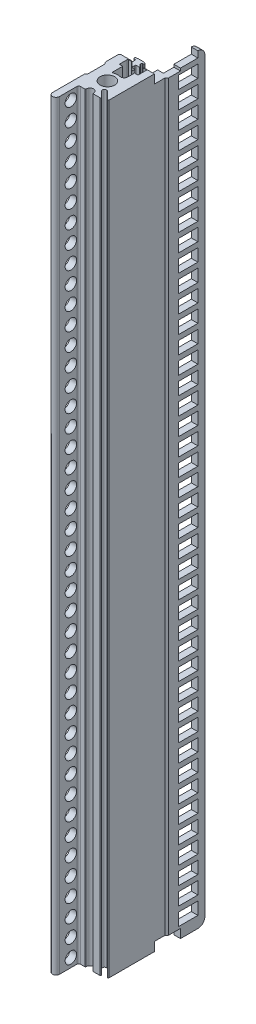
SolidWorks part; units mm, degrees
ref_plane "前视基准面" through (0, 0, 0) normal (0, 0, 1) x (1, 0, 0)
ref_plane "上视基准面" through (0, 0, 0) normal (0, 1, 0) x (1, 0, 0)
ref_plane "右视基准面" through (0, 0, 0) normal (1, 0, 0) x (0, 0, -1)
sketch "草图1" plane through (0, 0, 0) normal (0, 1, 0) x (1, 0, 0)
  line L0 (-4.2, 11.9) -> (-3.9, 11.9)
  line L1 (-4.4, 12.2) -> (-4.4, 12.1)
  line L2 (-4.0328, 12.4) -> (-4.2, 12.4)
  line L3 (-3.85, 12.5) -> (-3.8914, 12.4586)
  line L4 (-2.05, 12.5) -> (-3.85, 12.5)
  line L5 (-2.0086, 12.4586) -> (-2.05, 12.5)
  line L6 (-1.7, 12.4) -> (-1.8672, 12.4)
  line L7 (-1.5, 12.1) -> (-1.5, 12.2)
  line L8 (-1.8, 11.9) -> (-1.7, 11.9)
  line L9 (-2, 11.4828) -> (-2, 11.7)
  line L10 (-1.3586, 10.7586) -> (-1.9414, 11.3414)
  line L11 (-1.3, 10.55) -> (-1.3, 10.6172)
  line L12 (-3.7, 11.7) -> (-3.7, 9.95)
  line L13 (-5, -10.75) -> (-5, -1.6)
  line L14 (-3, -10.75) -> (-3, -5.75)
  line L15 (-2.5, -5.25) -> (-1.15, -5.25)
  line L16 (1.6887, -3.3855) -> (3.2118, -4.9086)
  line L17 (2.5373, -2.537) -> (4.6586, -4.6583)
  line L18 (5, 15) -> (5, 5.1793)
  line L19 (3.6, 15) -> (5, 15)
  line L20 (3.6, 12.5) -> (3.6, 15)
  line L21 (1.95, 12.5) -> (3.6, 12.5)
  line L22 (1.95, 10.55) -> (1.95, 12.5)
  line L23 (2.85, 10.55) -> (1.95, 10.55)
  line L24 (2.85, 9.35) -> (2.85, 10.55)
  line L25 (1.95, 9.35) -> (2.85, 9.35)
  line L26 (1.95, 8.35) -> (1.95, 9.35)
  line L27 (2.85, 8.35) -> (1.95, 8.35)
  line L28 (2.85, 6.05) -> (2.85, 8.35)
  line L29 (1.95, 6.05) -> (2.85, 6.05)
  line L30 (1.95, 3.8856) -> (1.95, 6.05)
  line L31 (-1.45, 6.05) -> (-1.45, 2.9458)
  line L32 (-2.35, 6.05) -> (-1.45, 6.05)
  line L33 (-2.35, 8.35) -> (-2.35, 6.05)
  line L34 (-1.45, 8.35) -> (-2.35, 8.35)
  line L35 (-1.45, 9.35) -> (-1.45, 8.35)
  line L36 (-2.35, 9.35) -> (-1.45, 9.35)
  line L37 (-2.35, 10.55) -> (-2.35, 9.35)
  line L38 (-1.3, 10.55) -> (-2.35, 10.55)
  line L39 (-4.45, 7.7) -> (-4.7, 7.7) construction
  line L40 (-5, 7.4) -> (-4.7, 7.7) construction
  line L41 (-5, 4.4) -> (-5, 7.4)
  line L42 (-4.5499, 3.8998) -> (-5, 4.4)
  line L43 (-4.45, 8.5) -> (-4.45, 9.55)
  line L44 (-3.9, 9.75) -> (-4.25, 9.75)
  line L45 (-4.5499, 3.8998) -> (-4.5501, -1.1002)
  line L46 (-5, -1.6) -> (-4.5501, -1.1002)
  line L47 (4.9414, -1.9395) -> (4.6464, -1.6446) construction
  line L48 (5, -2.081) -> (5, -4.5169)
  line L49 (0, 0) -> (0, -5) construction
  line L50 (4.5, -1.291) -> (4.5, 4.3894) construction
  line L51 (-1.05, -5) -> (-1.05, -5.15)
  line L52 (1.05, -5) -> (1.05, -5.15)
  line L53 (1.15, -5.25) -> (3.0703, -5.25)
  line L54 (2.5373, -2.537) -> (1.6887, -3.3855) construction
  line L55 (5, 5.1793) -> (5, -2.081)
  line L56 (-4.45, 8.5) -> (-4.7, 8.5)
  line L57 (-4.7, 8.5) -> (-5, 8.2)
  line L58 (4.9414, 5.0379) -> (4.6464, 4.743) construction
  line L59 (-5, 8.2) -> (-5, 7.4)
  circle A0 centre (0, 0) radius 1.6
  arc A1 (-4.4, 12.1) -> (-4.2, 11.9) centre (-4.2, 12.1) ccw
  arc A2 (-4.2, 12.4) -> (-4.4, 12.2) centre (-4.2, 12.2) ccw
  arc A3 (-4.0328, 12.4) -> (-3.8914, 12.4586) centre (-4.0328, 12.6) ccw
  arc A4 (-2.0086, 12.4586) -> (-1.8672, 12.4) centre (-1.8672, 12.6) ccw
  arc A5 (-1.5, 12.2) -> (-1.7, 12.4) centre (-1.7, 12.2) ccw
  arc A6 (-1.7, 11.9) -> (-1.5, 12.1) centre (-1.7, 12.1) ccw
  arc A7 (-1.8, 11.9) -> (-2, 11.7) centre (-1.8, 11.7) ccw
  arc A8 (-2, 11.4828) -> (-1.9414, 11.3414) centre (-1.8, 11.4828) ccw
  arc A9 (-1.3, 10.6172) -> (-1.3586, 10.7586) centre (-1.5, 10.6172) ccw
  arc A10 (-5, -10.75) -> (-3, -10.75) centre (-4, -10.75) ccw
  arc A11 (3.0703, -5.25) -> (3.2118, -4.9086) centre (3.0703, -5.05) ccw
  arc A12 (-4.25, 9.75) -> (-4.45, 9.55) centre (-4.25, 9.55) ccw
  arc A13 (-3.9, 9.75) -> (-3.7, 9.95) centre (-3.9, 9.95) ccw
  arc A14 (5, -2.081) -> (4.9414, -1.9395) centre (4.8, -2.081) ccw construction
  arc A15 (4.9414, 5.0379) -> (5, 5.1793) centre (4.8, 5.1793) ccw construction
  arc A16 (4.6586, -4.6583) -> (5, -4.5169) centre (4.8, -4.5169) ccw
  arc A17 (2.5373, -2.537) -> (1.6887, -3.3855) centre (2.113, -2.9613) ccw
  arc A18 (0.7125, 2.9142) -> (-1.1719, 2.7616) centre (0, 0) ccw
  arc A19 (-1.45, 2.9458) -> (-1.1719, 2.7616) centre (-1.25, 2.9458) ccw
  arc A20 (0.7125, 2.9142) -> (1.95, 3.8856) centre (0.95, 3.8856) ccw
  arc A21 (-3.7, 11.7) -> (-3.9, 11.9) centre (-3.9, 11.7) ccw
  arc A22 (4.6464, -1.6446) -> (4.5, -1.291) centre (5, -1.291) cw construction
  arc A23 (4.5, 4.3894) -> (4.6464, 4.743) centre (5, 4.3894) cw construction
  arc A24 (1.05, -5) -> (-1.05, -5) centre (0, -5) ccw
  arc A25 (1.15, -5.25) -> (1.05, -5.15) centre (1.15, -5.15) cw
  arc A26 (-1.05, -5.15) -> (-1.15, -5.25) centre (-1.15, -5.15) cw
  arc A29 (-3, -5.75) -> (-2.5, -5.25) centre (-2.5, -5.75) cw
  point P104 (1.05, -5.25)
  dimension "D1" = 3.2
  dimension "D2" = 2.1
  dimension "D3" = 5.2
  dimension "D4" = 45
  dimension "D5" = 1.2
  dimension "D7" = 0.6
  dimension "D8" = 0.2
  dimension "D10" = 5
  dimension "D11" = 0.1
  dimension "D12" = 0.5
  dimension "D13" = 0.5
  dimension "D6" = 3
  dimension "D9" = 2.1225
  dimension "D14" = 0.25
  dimension "D15" = 0.8
extrude "凸台-拉伸1" add sketch "草图1" along normal mid plane 218.44
sketch "草图8" plane through (0, -109.22, 0) normal (0, -1, 0) x (-1, 0, 0)
  line L0 (2.35, 8.35) -> (1.45, 8.35) construction
  line L1 (-2.95, 5.85) -> (2.45, 5.85)
  line L2 (-2.95, 5.85) -> (-2.95, 8.35)
  line L3 (-2.95, 8.35) -> (2.45, 8.35)
  line L4 (2.45, 5.85) -> (2.45, 8.35)
  line L5 (-2.85, 8.35) -> (-2.85, 6.05) construction
  line L6 (2.35, 6.05) -> (2.35, 8.35) construction
  line L7 (1.45, 6.05) -> (2.35, 6.05) construction
  line L8 (-2.85, 9.35) -> (-1.95, 9.35) construction
  line L9 (-2.95, 9.35) -> (2.45, 9.35)
  line L10 (-2.95, 9.35) -> (-2.95, 10.55)
  line L11 (-2.95, 10.55) -> (2.45, 10.55)
  line L12 (2.45, 9.35) -> (2.45, 10.55)
  line L13 (2.35, 10.55) -> (1.3, 10.55) construction
  line L14 (-2.85, 10.55) -> (-2.85, 9.35) construction
  line L15 (2.35, 9.35) -> (2.35, 10.55) construction
  dimension "D1" = 0.1
  dimension "D2" = 0.1
  dimension "D3" = 0.2
  dimension "D4" = 0.1
  dimension "D5" = 0.1
extrude "切除-拉伸6" cut sketch "草图8" against normal through all
fillet "圆角2" radius 0.2 8 edges at (-2.45, 0, -5.85) (2.95, 0, -8.35) (2.95, 0, -5.85) (-2.45, 0, -8.35) (-2.45, 0, -9.35) (2.95, 0, -10.55) (2.95, 0, -9.35) (-2.45, 0, -10.55)
sketch "草图6" plane through (0, 109.22, 0) normal (0, 1, 0) x (1, 0, 0)
  line L0 (3.6, 12.5) -> (3.6, 22.5)
  line L1 (3.6, 22.5) -> (5.5, 22.5)
  line L2 (5.5, 22.5) -> (5.5, 12)
  line L3 (5.5, 12) -> (5, 11.5)
  line L4 (3.6, 12.5) -> (5, 11.5)
  line L5 (5, -4.5169) -> (5, 15) construction
  line L6 (-5, 8.2) -> (-5, 4.4) construction
  dimension "D4" = 11
  dimension "D1" = 10.5
  dimension "D2" = 10
  dimension "D3" = 45
extrude "凸台-拉伸2" add sketch "草图6" against normal up to surface (218.44 mm away)
sketch "草图2" plane through (0, 109.22, 0) normal (0, 1, 0) x (1, 0, 0)
  circle A0 centre (0, 0) radius 2.1
  dimension "D1" = 4.2
extrude "切除-拉伸1" cut sketch "草图2" against normal blind 10
sketch "草图3" plane through (0, -109.22, 0) normal (0, -1, 0) x (1, 0, 0)
  circle A0 centre (0, 0) radius 2.1
  dimension "D1" = 4.2
extrude "切除-拉伸2" cut sketch "草图3" against normal blind 10
sketch "草图4" plane through (-5, 0, 0) normal (-1, 0, 0) x (0, 0, 1)
  line L0 (1.6, -109.22) -> (10.75, -109.22) construction
  line L1 (11.75, -109.22) -> (11.75, 109.22) construction
  circle A0 centre (7.5, -106.68) radius 1.65
  circle A1 centre (7.5, -101.6) radius 1.65
  circle A2 centre (7.5, -96.52) radius 1.65
  circle A3 centre (7.5, -91.44) radius 1.65
  circle A4 centre (7.5, -86.36) radius 1.65
  circle A5 centre (7.5, -81.28) radius 1.65
  circle A6 centre (7.5, -76.2) radius 1.65
  circle A7 centre (7.5, -71.12) radius 1.65
  circle A8 centre (7.5, -66.04) radius 1.65
  circle A9 centre (7.5, -60.96) radius 1.65
  circle A10 centre (7.5, -55.88) radius 1.65
  circle A11 centre (7.5, -50.8) radius 1.65
  circle A12 centre (7.5, -45.72) radius 1.65
  circle A13 centre (7.5, -40.64) radius 1.65
  circle A14 centre (7.5, -35.56) radius 1.65
  circle A15 centre (7.5, -30.48) radius 1.65
  circle A16 centre (7.5, -25.4) radius 1.65
  circle A17 centre (7.5, -20.32) radius 1.65
  circle A18 centre (7.5, -15.24) radius 1.65
  circle A19 centre (7.5, -10.16) radius 1.65
  circle A20 centre (7.5, -5.08) radius 1.65
  circle A21 centre (7.5, 0) radius 1.65
  circle A22 centre (7.5, 5.08) radius 1.65
  circle A23 centre (7.5, 10.16) radius 1.65
  circle A24 centre (7.5, 15.24) radius 1.65
  circle A25 centre (7.5, 20.32) radius 1.65
  circle A26 centre (7.5, 25.4) radius 1.65
  circle A27 centre (7.5, 30.48) radius 1.65
  circle A28 centre (7.5, 35.56) radius 1.65
  circle A29 centre (7.5, 40.64) radius 1.65
  circle A30 centre (7.5, 45.72) radius 1.65
  circle A31 centre (7.5, 50.8) radius 1.65
  circle A32 centre (7.5, 55.88) radius 1.65
  circle A33 centre (7.5, 60.96) radius 1.65
  circle A34 centre (7.5, 66.04) radius 1.65
  circle A35 centre (7.5, 71.12) radius 1.65
  circle A36 centre (7.5, 76.2) radius 1.65
  circle A37 centre (7.5, 81.28) radius 1.65
  circle A38 centre (7.5, 86.36) radius 1.65
  circle A39 centre (7.5, 91.44) radius 1.65
  circle A40 centre (7.5, 96.52) radius 1.65
  circle A41 centre (7.5, 101.6) radius 1.65
  circle A42 centre (7.5, 106.68) radius 1.65
  circle A43 centre (7.5, 111.76) radius 1.65
  circle A44 centre (7.5, 116.84) radius 1.65
  circle A45 centre (7.5, 121.92) radius 1.65
  circle A46 centre (7.5, 127) radius 1.65
  circle A47 centre (7.5, 132.08) radius 1.65
  circle A48 centre (7.5, 137.16) radius 1.65
  circle A49 centre (7.5, 142.24) radius 1.65
  circle A50 centre (7.5, 147.32) radius 1.65
  circle A51 centre (7.5, 152.4) radius 1.65
  circle A52 centre (7.5, 157.48) radius 1.65
  circle A53 centre (7.5, 162.56) radius 1.65
  circle A54 centre (7.5, 167.64) radius 1.65
  circle A55 centre (7.5, 172.72) radius 1.65
  circle A56 centre (7.5, 177.8) radius 1.65
  circle A57 centre (7.5, 182.88) radius 1.65
  circle A58 centre (7.5, 187.96) radius 1.65
  circle A59 centre (7.5, 193.04) radius 1.65
  circle A60 centre (7.5, 198.12) radius 1.65
  circle A61 centre (7.5, 203.2) radius 1.65
  circle A62 centre (7.5, 208.28) radius 1.65
  circle A63 centre (7.5, 213.36) radius 1.65
  circle A64 centre (7.5, 218.44) radius 1.65
  circle A65 centre (7.5, 223.52) radius 1.65
  circle A66 centre (7.5, 228.6) radius 1.65
  circle A67 centre (7.5, 233.68) radius 1.65
  circle A68 centre (7.5, 238.76) radius 1.65
  circle A69 centre (7.5, 243.84) radius 1.65
  circle A70 centre (7.5, 248.92) radius 1.65
  circle A71 centre (7.5, 254) radius 1.65
  circle A72 centre (7.5, 259.08) radius 1.65
  circle A73 centre (7.5, 264.16) radius 1.65
  circle A74 centre (7.5, 269.24) radius 1.65
  circle A75 centre (7.5, 274.32) radius 1.65
  circle A76 centre (7.5, 279.4) radius 1.65
  circle A77 centre (7.5, 284.48) radius 1.65
  circle A78 centre (7.5, 289.56) radius 1.65
  circle A79 centre (7.5, 294.64) radius 1.65
  circle A80 centre (7.5, 299.72) radius 1.65
  circle A81 centre (7.5, 304.8) radius 1.65
  circle A82 centre (7.5, 309.88) radius 1.65
  circle A83 centre (7.5, 314.96) radius 1.65
  circle A84 centre (7.5, 320.04) radius 1.65
  dimension "D1" = 2.54
  dimension "D2" = 4.25
  dimension "D3" = 3.3
  dimension "D5" = 5.08
  dimension "D4" = 85
extrude "切除-拉伸3" cut sketch "草图4" against normal blind 12
sketch "草图5" plane through (5.5, 0, 0) normal (1, 0, 0) x (0, 0, -1)
  line L0 (-19.1753, 0) -> (41.1348, 0) construction
  line L1 (15.5, 109.22) -> (8.5, 109.22)
  line L2 (15.5, 109.22) -> (15.5, 106.68)
  line L3 (15.5, 106.68) -> (8.5, 106.68)
  line L4 (8.5, 109.22) -> (8.5, 106.68)
  line L6 (8.5, -109.22) -> (8.5, -106.68)
  line L7 (15.5, -106.68) -> (8.5, -106.68)
  line L8 (15.5, -109.22) -> (15.5, -106.68)
  line L9 (15.5, -109.22) -> (8.5, -109.22)
  line L10 (12, 109.22) -> (22.5, 109.22) construction
  line L11 (22.5, -109.22) -> (22.5, 109.22) construction
  dimension "D1" = 7
  dimension "D2" = 2.54
  dimension "D3" = 7
extrude "切除-拉伸4" cut sketch "草图5" against normal through all
sketch "草图7" plane through (5.5, 0, 0) normal (1, 0, 0) x (0, 0, -1)
  line L0 (22.5, -109.22) -> (22.5, 109.22) construction
  line L1 (15, -105.94) -> (20.5, -105.94)
  line L2 (15, -105.94) -> (15, -102.34)
  line L3 (15, -102.34) -> (20.5, -102.34)
  line L4 (20.5, -105.94) -> (20.5, -102.34)
  line L5 (22.5, -109.22) -> (15.5, -109.22) construction
  line L6 (15, -100.86) -> (20.5, -100.86)
  line L7 (15, -100.86) -> (15, -97.26)
  line L8 (15, -97.26) -> (20.5, -97.26)
  line L9 (20.5, -100.86) -> (20.5, -97.26)
  line L10 (15, -95.78) -> (20.5, -95.78)
  line L11 (15, -95.78) -> (15, -92.18)
  line L12 (15, -92.18) -> (20.5, -92.18)
  line L13 (20.5, -95.78) -> (20.5, -92.18)
  line L14 (15, -90.7) -> (20.5, -90.7)
  line L15 (15, -90.7) -> (15, -87.1)
  line L16 (15, -87.1) -> (20.5, -87.1)
  line L17 (20.5, -90.7) -> (20.5, -87.1)
  line L18 (15, -85.62) -> (20.5, -85.62)
  line L19 (15, -85.62) -> (15, -82.02)
  line L20 (15, -82.02) -> (20.5, -82.02)
  line L21 (20.5, -85.62) -> (20.5, -82.02)
  line L22 (15, -80.54) -> (20.5, -80.54)
  line L23 (15, -80.54) -> (15, -76.94)
  line L24 (15, -76.94) -> (20.5, -76.94)
  line L25 (20.5, -80.54) -> (20.5, -76.94)
  line L26 (15, -75.46) -> (20.5, -75.46)
  line L27 (15, -75.46) -> (15, -71.86)
  line L28 (15, -71.86) -> (20.5, -71.86)
  line L29 (20.5, -75.46) -> (20.5, -71.86)
  line L30 (15, -70.38) -> (20.5, -70.38)
  line L31 (15, -70.38) -> (15, -66.78)
  line L32 (15, -66.78) -> (20.5, -66.78)
  line L33 (20.5, -70.38) -> (20.5, -66.78)
  line L34 (15, -65.3) -> (20.5, -65.3)
  line L35 (15, -65.3) -> (15, -61.7)
  line L36 (15, -61.7) -> (20.5, -61.7)
  line L37 (20.5, -65.3) -> (20.5, -61.7)
  line L38 (15, -60.22) -> (20.5, -60.22)
  line L39 (15, -60.22) -> (15, -56.62)
  line L40 (15, -56.62) -> (20.5, -56.62)
  line L41 (20.5, -60.22) -> (20.5, -56.62)
  line L42 (15, -55.14) -> (20.5, -55.14)
  line L43 (15, -55.14) -> (15, -51.54)
  line L44 (15, -51.54) -> (20.5, -51.54)
  line L45 (20.5, -55.14) -> (20.5, -51.54)
  line L46 (15, -50.06) -> (20.5, -50.06)
  line L47 (15, -50.06) -> (15, -46.46)
  line L48 (15, -46.46) -> (20.5, -46.46)
  line L49 (20.5, -50.06) -> (20.5, -46.46)
  line L50 (15, -44.98) -> (20.5, -44.98)
  line L51 (15, -44.98) -> (15, -41.38)
  line L52 (15, -41.38) -> (20.5, -41.38)
  line L53 (20.5, -44.98) -> (20.5, -41.38)
  line L54 (15, -39.9) -> (20.5, -39.9)
  line L55 (15, -39.9) -> (15, -36.3)
  line L56 (15, -36.3) -> (20.5, -36.3)
  line L57 (20.5, -39.9) -> (20.5, -36.3)
  line L58 (15, -34.82) -> (20.5, -34.82)
  line L59 (15, -34.82) -> (15, -31.22)
  line L60 (15, -31.22) -> (20.5, -31.22)
  line L61 (20.5, -34.82) -> (20.5, -31.22)
  line L62 (15, -29.74) -> (20.5, -29.74)
  line L63 (15, -29.74) -> (15, -26.14)
  line L64 (15, -26.14) -> (20.5, -26.14)
  line L65 (20.5, -29.74) -> (20.5, -26.14)
  line L66 (15, -24.66) -> (20.5, -24.66)
  line L67 (15, -24.66) -> (15, -21.06)
  line L68 (15, -21.06) -> (20.5, -21.06)
  line L69 (20.5, -24.66) -> (20.5, -21.06)
  line L70 (15, -19.58) -> (20.5, -19.58)
  line L71 (15, -19.58) -> (15, -15.98)
  line L72 (15, -15.98) -> (20.5, -15.98)
  line L73 (20.5, -19.58) -> (20.5, -15.98)
  line L74 (15, -14.5) -> (20.5, -14.5)
  line L75 (15, -14.5) -> (15, -10.9)
  line L76 (15, -10.9) -> (20.5, -10.9)
  line L77 (20.5, -14.5) -> (20.5, -10.9)
  line L78 (15, -9.42) -> (20.5, -9.42)
  line L79 (15, -9.42) -> (15, -5.82)
  line L80 (15, -5.82) -> (20.5, -5.82)
  line L81 (20.5, -9.42) -> (20.5, -5.82)
  line L82 (15, -4.34) -> (20.5, -4.34)
  line L83 (15, -4.34) -> (15, -0.74)
  line L84 (15, -0.74) -> (20.5, -0.74)
  line L85 (20.5, -4.34) -> (20.5, -0.74)
  line L86 (15, 0.74) -> (20.5, 0.74)
  line L87 (15, 0.74) -> (15, 4.34)
  line L88 (15, 4.34) -> (20.5, 4.34)
  line L89 (20.5, 0.74) -> (20.5, 4.34)
  line L90 (15, 5.82) -> (20.5, 5.82)
  line L91 (15, 5.82) -> (15, 9.42)
  line L92 (15, 9.42) -> (20.5, 9.42)
  line L93 (20.5, 5.82) -> (20.5, 9.42)
  line L94 (15, 10.9) -> (20.5, 10.9)
  line L95 (15, 10.9) -> (15, 14.5)
  line L96 (15, 14.5) -> (20.5, 14.5)
  line L97 (20.5, 10.9) -> (20.5, 14.5)
  line L98 (15, 15.98) -> (20.5, 15.98)
  line L99 (15, 15.98) -> (15, 19.58)
  line L100 (15, 19.58) -> (20.5, 19.58)
  line L101 (20.5, 15.98) -> (20.5, 19.58)
  line L102 (15, 21.06) -> (20.5, 21.06)
  line L103 (15, 21.06) -> (15, 24.66)
  line L104 (15, 24.66) -> (20.5, 24.66)
  line L105 (20.5, 21.06) -> (20.5, 24.66)
  line L106 (15, 26.14) -> (20.5, 26.14)
  line L107 (15, 26.14) -> (15, 29.74)
  line L108 (15, 29.74) -> (20.5, 29.74)
  line L109 (20.5, 26.14) -> (20.5, 29.74)
  line L110 (15, 31.22) -> (20.5, 31.22)
  line L111 (15, 31.22) -> (15, 34.82)
  line L112 (15, 34.82) -> (20.5, 34.82)
  line L113 (20.5, 31.22) -> (20.5, 34.82)
  line L114 (15, 36.3) -> (20.5, 36.3)
  line L115 (15, 36.3) -> (15, 39.9)
  line L116 (15, 39.9) -> (20.5, 39.9)
  line L117 (20.5, 36.3) -> (20.5, 39.9)
  line L118 (15, 41.38) -> (20.5, 41.38)
  line L119 (15, 41.38) -> (15, 44.98)
  line L120 (15, 44.98) -> (20.5, 44.98)
  line L121 (20.5, 41.38) -> (20.5, 44.98)
  line L122 (15, 46.46) -> (20.5, 46.46)
  line L123 (15, 46.46) -> (15, 50.06)
  line L124 (15, 50.06) -> (20.5, 50.06)
  line L125 (20.5, 46.46) -> (20.5, 50.06)
  line L126 (15, 51.54) -> (20.5, 51.54)
  line L127 (15, 51.54) -> (15, 55.14)
  line L128 (15, 55.14) -> (20.5, 55.14)
  line L129 (20.5, 51.54) -> (20.5, 55.14)
  line L130 (15, 56.62) -> (20.5, 56.62)
  line L131 (15, 56.62) -> (15, 60.22)
  line L132 (15, 60.22) -> (20.5, 60.22)
  line L133 (20.5, 56.62) -> (20.5, 60.22)
  line L134 (15, 61.7) -> (20.5, 61.7)
  line L135 (15, 61.7) -> (15, 65.3)
  line L136 (15, 65.3) -> (20.5, 65.3)
  line L137 (20.5, 61.7) -> (20.5, 65.3)
  line L138 (15, 66.78) -> (20.5, 66.78)
  line L139 (15, 66.78) -> (15, 70.38)
  line L140 (15, 70.38) -> (20.5, 70.38)
  line L141 (20.5, 66.78) -> (20.5, 70.38)
  line L142 (15, 71.86) -> (20.5, 71.86)
  line L143 (15, 71.86) -> (15, 75.46)
  line L144 (15, 75.46) -> (20.5, 75.46)
  line L145 (20.5, 71.86) -> (20.5, 75.46)
  line L146 (15, 76.94) -> (20.5, 76.94)
  line L147 (15, 76.94) -> (15, 80.54)
  line L148 (15, 80.54) -> (20.5, 80.54)
  line L149 (20.5, 76.94) -> (20.5, 80.54)
  line L150 (15, 82.02) -> (20.5, 82.02)
  line L151 (15, 82.02) -> (15, 85.62)
  line L152 (15, 85.62) -> (20.5, 85.62)
  line L153 (20.5, 82.02) -> (20.5, 85.62)
  line L154 (15, 87.1) -> (20.5, 87.1)
  line L155 (15, 87.1) -> (15, 90.7)
  line L156 (15, 90.7) -> (20.5, 90.7)
  line L157 (20.5, 87.1) -> (20.5, 90.7)
  line L158 (15, 92.18) -> (20.5, 92.18)
  line L159 (15, 92.18) -> (15, 95.78)
  line L160 (15, 95.78) -> (20.5, 95.78)
  line L161 (20.5, 92.18) -> (20.5, 95.78)
  line L162 (15, 97.26) -> (20.5, 97.26)
  line L163 (15, 97.26) -> (15, 100.86)
  line L164 (15, 100.86) -> (20.5, 100.86)
  line L165 (20.5, 97.26) -> (20.5, 100.86)
  line L166 (15, 102.34) -> (20.5, 102.34)
  line L167 (15, 102.34) -> (15, 105.94)
  line L168 (15, 105.94) -> (20.5, 105.94)
  line L169 (20.5, 102.34) -> (20.5, 105.94)
  line L170 (15, 107.42) -> (20.5, 107.42)
  line L171 (15, 107.42) -> (15, 111.02)
  line L172 (15, 111.02) -> (20.5, 111.02)
  line L173 (20.5, 107.42) -> (20.5, 111.02)
  line L174 (15, 112.5) -> (20.5, 112.5)
  line L175 (15, 112.5) -> (15, 116.1)
  line L176 (15, 116.1) -> (20.5, 116.1)
  line L177 (20.5, 112.5) -> (20.5, 116.1)
  line L178 (15, 117.58) -> (20.5, 117.58)
  line L179 (15, 117.58) -> (15, 121.18)
  line L180 (15, 121.18) -> (20.5, 121.18)
  line L181 (20.5, 117.58) -> (20.5, 121.18)
  line L182 (15, 122.66) -> (20.5, 122.66)
  line L183 (15, 122.66) -> (15, 126.26)
  line L184 (15, 126.26) -> (20.5, 126.26)
  line L185 (20.5, 122.66) -> (20.5, 126.26)
  line L186 (15, 127.74) -> (20.5, 127.74)
  line L187 (15, 127.74) -> (15, 131.34)
  line L188 (15, 131.34) -> (20.5, 131.34)
  line L189 (20.5, 127.74) -> (20.5, 131.34)
  line L190 (15, 132.82) -> (20.5, 132.82)
  line L191 (15, 132.82) -> (15, 136.42)
  line L192 (15, 136.42) -> (20.5, 136.42)
  line L193 (20.5, 132.82) -> (20.5, 136.42)
  line L194 (15, 137.9) -> (20.5, 137.9)
  line L195 (15, 137.9) -> (15, 141.5)
  line L196 (15, 141.5) -> (20.5, 141.5)
  line L197 (20.5, 137.9) -> (20.5, 141.5)
  line L198 (15, 142.98) -> (20.5, 142.98)
  line L199 (15, 142.98) -> (15, 146.58)
  line L200 (15, 146.58) -> (20.5, 146.58)
  line L201 (20.5, 142.98) -> (20.5, 146.58)
  line L202 (15, 148.06) -> (20.5, 148.06)
  line L203 (15, 148.06) -> (15, 151.66)
  line L204 (15, 151.66) -> (20.5, 151.66)
  line L205 (20.5, 148.06) -> (20.5, 151.66)
  line L206 (15, 153.14) -> (20.5, 153.14)
  line L207 (15, 153.14) -> (15, 156.74)
  line L208 (15, 156.74) -> (20.5, 156.74)
  line L209 (20.5, 153.14) -> (20.5, 156.74)
  line L210 (15, 158.22) -> (20.5, 158.22)
  line L211 (15, 158.22) -> (15, 161.82)
  line L212 (15, 161.82) -> (20.5, 161.82)
  line L213 (20.5, 158.22) -> (20.5, 161.82)
  line L214 (15, 163.3) -> (20.5, 163.3)
  line L215 (15, 163.3) -> (15, 166.9)
  line L216 (15, 166.9) -> (20.5, 166.9)
  line L217 (20.5, 163.3) -> (20.5, 166.9)
  line L218 (15, 168.38) -> (20.5, 168.38)
  line L219 (15, 168.38) -> (15, 171.98)
  line L220 (15, 171.98) -> (20.5, 171.98)
  line L221 (20.5, 168.38) -> (20.5, 171.98)
  line L222 (15, 173.46) -> (20.5, 173.46)
  line L223 (15, 173.46) -> (15, 177.06)
  line L224 (15, 177.06) -> (20.5, 177.06)
  line L225 (20.5, 173.46) -> (20.5, 177.06)
  line L226 (15, 178.54) -> (20.5, 178.54)
  line L227 (15, 178.54) -> (15, 182.14)
  line L228 (15, 182.14) -> (20.5, 182.14)
  line L229 (20.5, 178.54) -> (20.5, 182.14)
  line L230 (15, 183.62) -> (20.5, 183.62)
  line L231 (15, 183.62) -> (15, 187.22)
  line L232 (15, 187.22) -> (20.5, 187.22)
  line L233 (20.5, 183.62) -> (20.5, 187.22)
  line L234 (15, 188.7) -> (20.5, 188.7)
  line L235 (15, 188.7) -> (15, 192.3)
  line L236 (15, 192.3) -> (20.5, 192.3)
  line L237 (20.5, 188.7) -> (20.5, 192.3)
  line L238 (15, 193.78) -> (20.5, 193.78)
  line L239 (15, 193.78) -> (15, 197.38)
  line L240 (15, 197.38) -> (20.5, 197.38)
  line L241 (20.5, 193.78) -> (20.5, 197.38)
  line L242 (15, 198.86) -> (20.5, 198.86)
  line L243 (15, 198.86) -> (15, 202.46)
  line L244 (15, 202.46) -> (20.5, 202.46)
  line L245 (20.5, 198.86) -> (20.5, 202.46)
  line L246 (15, 203.94) -> (20.5, 203.94)
  line L247 (15, 203.94) -> (15, 207.54)
  line L248 (15, 207.54) -> (20.5, 207.54)
  line L249 (20.5, 203.94) -> (20.5, 207.54)
  line L250 (15, 209.02) -> (20.5, 209.02)
  line L251 (15, 209.02) -> (15, 212.62)
  line L252 (15, 212.62) -> (20.5, 212.62)
  line L253 (20.5, 209.02) -> (20.5, 212.62)
  line L254 (15, 214.1) -> (20.5, 214.1)
  line L255 (15, 214.1) -> (15, 217.7)
  line L256 (15, 217.7) -> (20.5, 217.7)
  line L257 (20.5, 214.1) -> (20.5, 217.7)
  line L258 (15, 219.18) -> (20.5, 219.18)
  line L259 (15, 219.18) -> (15, 222.78)
  line L260 (15, 222.78) -> (20.5, 222.78)
  line L261 (20.5, 219.18) -> (20.5, 222.78)
  line L262 (15, 224.26) -> (20.5, 224.26)
  line L263 (15, 224.26) -> (15, 227.86)
  line L264 (15, 227.86) -> (20.5, 227.86)
  line L265 (20.5, 224.26) -> (20.5, 227.86)
  line L266 (15, 229.34) -> (20.5, 229.34)
  line L267 (15, 229.34) -> (15, 232.94)
  line L268 (15, 232.94) -> (20.5, 232.94)
  line L269 (20.5, 229.34) -> (20.5, 232.94)
  line L270 (15, 234.42) -> (20.5, 234.42)
  line L271 (15, 234.42) -> (15, 238.02)
  line L272 (15, 238.02) -> (20.5, 238.02)
  line L273 (20.5, 234.42) -> (20.5, 238.02)
  line L274 (15, 239.5) -> (20.5, 239.5)
  line L275 (15, 239.5) -> (15, 243.1)
  line L276 (15, 243.1) -> (20.5, 243.1)
  line L277 (20.5, 239.5) -> (20.5, 243.1)
  line L278 (15, 244.58) -> (20.5, 244.58)
  line L279 (15, 244.58) -> (15, 248.18)
  line L280 (15, 248.18) -> (20.5, 248.18)
  line L281 (20.5, 244.58) -> (20.5, 248.18)
  line L282 (15, 249.66) -> (20.5, 249.66)
  line L283 (15, 249.66) -> (15, 253.26)
  line L284 (15, 253.26) -> (20.5, 253.26)
  line L285 (20.5, 249.66) -> (20.5, 253.26)
  line L286 (15, 254.74) -> (20.5, 254.74)
  line L287 (15, 254.74) -> (15, 258.34)
  line L288 (15, 258.34) -> (20.5, 258.34)
  line L289 (20.5, 254.74) -> (20.5, 258.34)
  line L290 (15, 259.82) -> (20.5, 259.82)
  line L291 (15, 259.82) -> (15, 263.42)
  line L292 (15, 263.42) -> (20.5, 263.42)
  line L293 (20.5, 259.82) -> (20.5, 263.42)
  line L294 (15, 264.9) -> (20.5, 264.9)
  line L295 (15, 264.9) -> (15, 268.5)
  line L296 (15, 268.5) -> (20.5, 268.5)
  line L297 (20.5, 264.9) -> (20.5, 268.5)
  line L298 (15, 269.98) -> (20.5, 269.98)
  line L299 (15, 269.98) -> (15, 273.58)
  line L300 (15, 273.58) -> (20.5, 273.58)
  line L301 (20.5, 269.98) -> (20.5, 273.58)
  line L302 (15, 275.06) -> (20.5, 275.06)
  line L303 (15, 275.06) -> (15, 278.66)
  line L304 (15, 278.66) -> (20.5, 278.66)
  line L305 (20.5, 275.06) -> (20.5, 278.66)
  line L306 (15, 280.14) -> (20.5, 280.14)
  line L307 (15, 280.14) -> (15, 283.74)
  line L308 (15, 283.74) -> (20.5, 283.74)
  line L309 (20.5, 280.14) -> (20.5, 283.74)
  line L310 (15, 285.22) -> (20.5, 285.22)
  line L311 (15, 285.22) -> (15, 288.82)
  line L312 (15, 288.82) -> (20.5, 288.82)
  line L313 (20.5, 285.22) -> (20.5, 288.82)
  line L314 (15, 290.3) -> (20.5, 290.3)
  line L315 (15, 290.3) -> (15, 293.9)
  line L316 (15, 293.9) -> (20.5, 293.9)
  line L317 (20.5, 290.3) -> (20.5, 293.9)
  line L318 (15, 295.38) -> (20.5, 295.38)
  line L319 (15, 295.38) -> (15, 298.98)
  line L320 (15, 298.98) -> (20.5, 298.98)
  line L321 (20.5, 295.38) -> (20.5, 298.98)
  line L322 (15, 300.46) -> (20.5, 300.46)
  line L323 (15, 300.46) -> (15, 304.06)
  line L324 (15, 304.06) -> (20.5, 304.06)
  line L325 (20.5, 300.46) -> (20.5, 304.06)
  line L326 (15, 305.54) -> (20.5, 305.54)
  line L327 (15, 305.54) -> (15, 309.14)
  line L328 (15, 309.14) -> (20.5, 309.14)
  line L329 (20.5, 305.54) -> (20.5, 309.14)
  line L330 (15, 310.62) -> (20.5, 310.62)
  line L331 (15, 310.62) -> (15, 314.22)
  line L332 (15, 314.22) -> (20.5, 314.22)
  line L333 (20.5, 310.62) -> (20.5, 314.22)
  line L334 (15, 315.7) -> (20.5, 315.7)
  line L335 (15, 315.7) -> (15, 319.3)
  line L336 (15, 319.3) -> (20.5, 319.3)
  line L337 (20.5, 315.7) -> (20.5, 319.3)
  dimension "D1" = 3.6
  dimension "D2" = 5.5
  dimension "D3" = 2
  dimension "D4" = 3.28
  dimension "D5" = 84
extrude "切除-拉伸5" cut sketch "草图7" against normal blind 10
fillet "圆角1" radius 2 2 edges at (4.55, -109.22, -22.5) (4.55, 109.22, -22.5)
